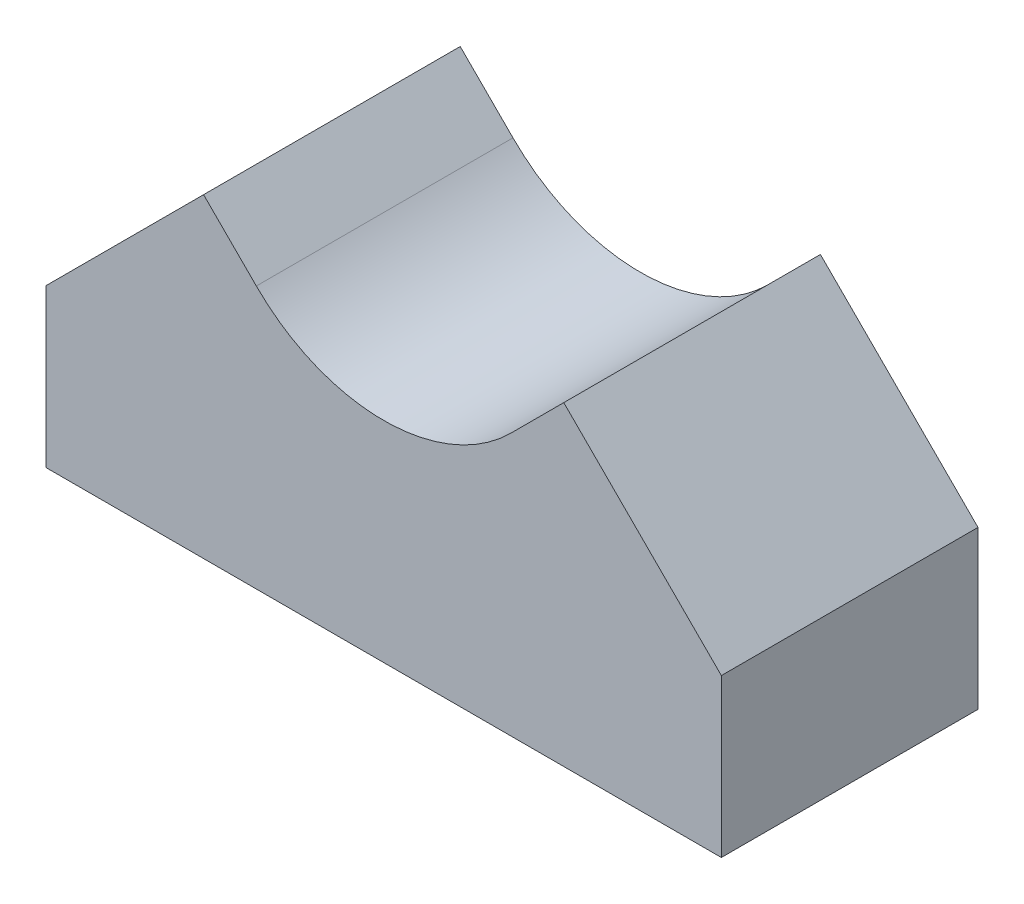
SolidWorks part; units mm, degrees
ref_plane "Front Plane" through (0, 0, 0) normal (0, 0, 1) x (1, 0, 0)
ref_plane "Top Plane" through (0, 0, 0) normal (0, 1, 0) x (1, 0, 0)
ref_plane "Right Plane" through (0, 0, 0) normal (1, 0, 0) x (0, 0, -1)
sketch "Sketch1" plane through (0, 0, 0) normal (0, 0, 1) x (1, 0, 0)
  line L0 (0, 0) -> (0, 35)
  line L1 (0, 35) -> (35, 70)
  line L2 (35, 70) -> (50, 55)
  line L3 (50, 55) -> (100, 55)
  line L4 (75, 55) -> (75, 0) construction
  line L6 (115, 70) -> (100, 55)
  line L7 (150, 0) -> (0, 0)
  line L9 (150, 35) -> (115, 70)
  line L10 (150, 0) -> (150, 35)
  dimension "D1" = 35
  dimension "D2" = 135
  dimension "D3" = 35
  dimension "D4" = 55
  dimension "D5" = 150
extrude "Extrude1" add sketch "Sketch1" along normal blind 57
fillet "Fillet1" radius 40 4 edges at (50, 55, 28.5) (100, 55, 28.5) (75, 55, 57) (75, 55, 0)
